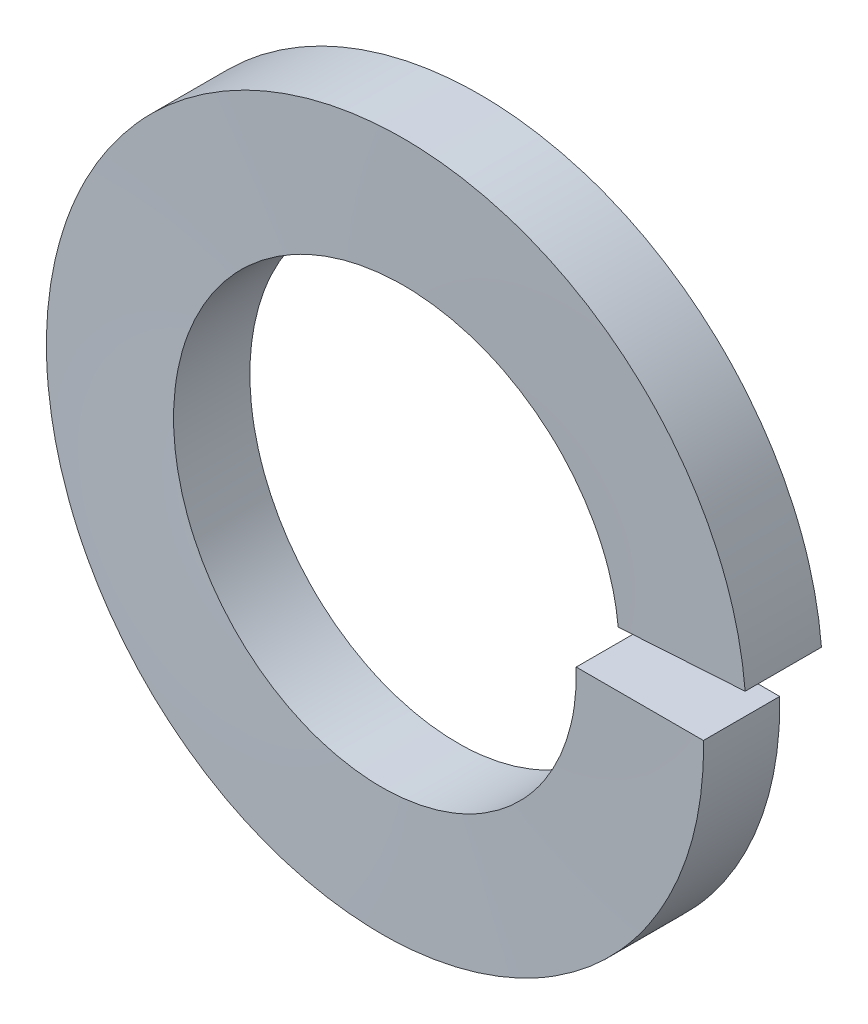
SolidWorks part; units mm, degrees
ref_plane "Plan de face" through (0, 0, 0) normal (0, 0, 1) x (1, 0, 0)
ref_plane "Plan de dessus" through (0, 0, 0) normal (0, 1, 0) x (1, 0, 0)
ref_plane "Plan de droite" through (0, 0, 0) normal (1, 0, 0) x (0, 0, -1)
imported_body "Importée3"
ref_plane "Plan1" through (0, 0, -1) normal (0, 0, 1) x (1, 0, 0)
sketch "Esquisse1" plane through (0, 0, -1) normal (0, 0, 1) x (1, 0, 0)
  circle A0 centre (0, 0) radius 5
extrude "Boss.-Extru.1" add sketch "Esquisse1" against normal blind 1.8
sketch "Esquisse2" plane through (0, 0, -1) normal (0, 0, 1) x (1, 0, 0)
  arc A0 (5, 0) -> (4.9903, 0.3108) centre (0, 0) ccw
  arc A1 (4.9903, 0.3108) -> (5, 0) centre (0, 0) ccw
extrude "Enlèv. mat.-Extru.1" cut sketch "Esquisse2" against normal blind 0.8
sketch "Esquisse3" plane through (0, 0, -1.8) normal (0, 0, 1) x (1, 0, 0)
  circle A0 centre (0, 0) radius 5
extrude "Boss.-Extru.2" add sketch "Esquisse3" along normal blind 1.8
sketch "Esquisse4" plane through (0, 0, 0) normal (0, 1, 0) x (1, 0, 0)
  line L0 (5, 2.8) -> (0, 2.8)
  line L1 (0, 2.8) -> (0, 0)
  line L2 (0, 0) -> (5, 0)
  line L3 (5, 0) -> (5, 2.8)
  line L4 (0, 2.8) -> (0, 0) construction
revolve "Enlèvement de matière-Révolution1" cut sketch "Esquisse4" angle 360 about L4
sketch "Esquisse9" plane through (0, 0, -1) normal (0, 0, 1) x (1, 0, 0)
  circle A0 centre (0, 0) radius 5
extrude "Boss.-Extru.3" add sketch "Esquisse9" against normal blind 1.8
sketch "Esquisse10" plane through (0, 0, -1) normal (0, 0, 1) x (1, 0, 0)
  arc A0 (5, 0) -> (4.9903, 0.3108) centre (0, 0) ccw
  arc A1 (4.9903, 0.3108) -> (5, 0) centre (0, 0) ccw
extrude "Enlèv. mat.-Extru.2" cut sketch "Esquisse10" against normal blind 0.8
sketch "Esquisse11" plane through (0, 0, -1.8) normal (0, 0, 1) x (1, 0, 0)
  circle A0 centre (0, 0) radius 5
extrude "Boss.-Extru.4" add sketch "Esquisse11" along normal blind 1.8
sketch "Esquisse14" plane through (0, 0, 0) normal (0, 1, 0) x (1, 0, 0)
  line L0 (5, 2.8) -> (0, 2.8)
  line L1 (0, 2.8) -> (0, 0)
  line L2 (0, 0) -> (5, 0)
  line L3 (5, 0) -> (5, 2.8)
  line L4 (0, 2.8) -> (0, 0) construction
revolve "Enlèvement de matière-Révolution2" cut sketch "Esquisse14" angle 360 about L1
sketch "Esquisse19" plane through (0, 0, -1) normal (0, 0, 1) x (1, 0, 0)
  circle A0 centre (0, 0) radius 5
extrude "Boss.-Extru.5" add sketch "Esquisse19" against normal blind 1.8
sketch "Esquisse20" plane through (0, 0, -1) normal (0, 0, 1) x (1, 0, 0)
  arc A0 (4.9903, 0.3108) -> (5, 0) centre (0, 0) ccw
  arc A1 (5, 0) -> (4.9903, 0.3108) centre (0, 0) ccw
extrude "Enlèv. mat.-Extru.3" cut sketch "Esquisse20" against normal blind 0.8
sketch "Esquisse21" plane through (0, 0, -1.8) normal (0, 0, 1) x (1, 0, 0)
  circle A0 centre (0, 0) radius 5
extrude "Boss.-Extru.6" add sketch "Esquisse21" along normal blind 1.8
ref_plane "Plan2" through (0, 0, 0) normal (0, -1, 0) x (-1, 0, 0)
sketch "Esquisse26" plane through (0, 0, 0) normal (0, -1, 0) x (-1, 0, 0)
  line L0 (-5, 0) -> (0, 0)
  line L1 (0, 0) -> (0, 2.8)
  line L2 (0, 2.8) -> (-5, 2.8)
  line L3 (-5, 2.8) -> (-5, 0)
  line L4 (0, 0) -> (0, 2.8) construction
revolve "Enlèvement de matière-Révolution3" cut sketch "Esquisse26" angle 360 about L1
